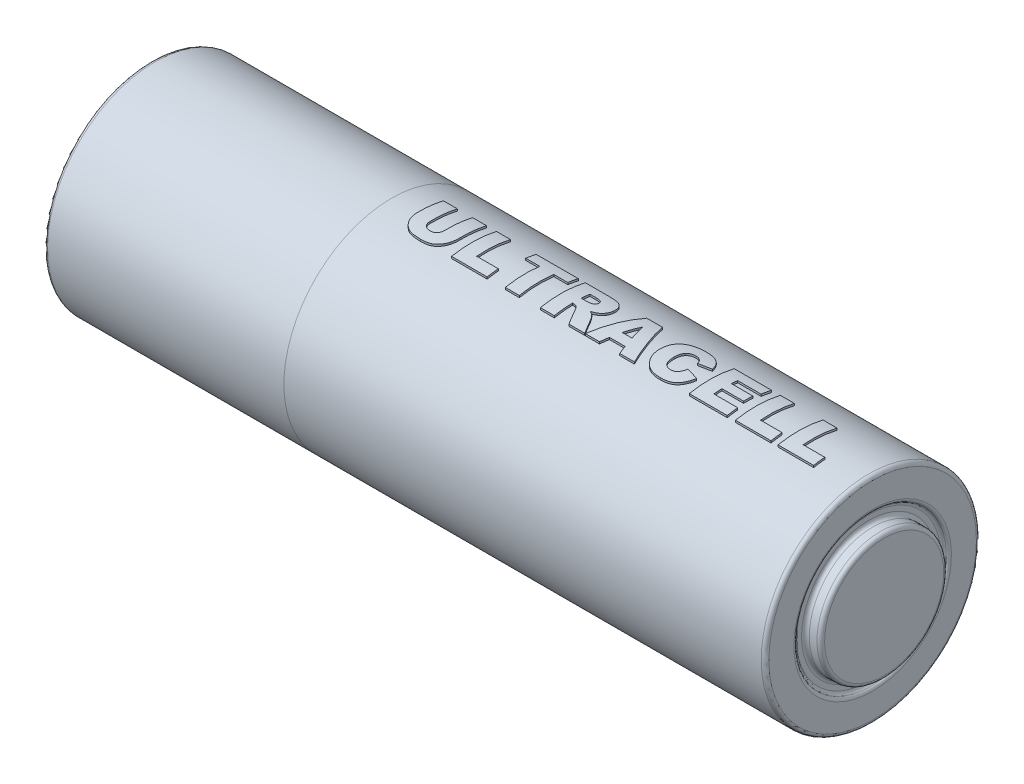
SolidWorks part; units mm, degrees
ref_plane "Plane1" through (0, 0, 0) normal (0, 0, 1) x (1, 0, 0)
ref_plane "Plane2" through (0, 0, 0) normal (0, 1, 0) x (1, 0, 0)
ref_plane "Plane3" through (0, 0, 0) normal (1, 0, 0) x (0, 0, -1)
sketch "Sketch1" plane through (0, 0, 0) normal (0, 0, 1) x (1, 0, 0)
  line L0 (0, 7.112) -> (47.6758, 7.112)
  line L1 (0, 7.112) -> (0, 0)
  line L2 (47.6758, 0) -> (0, 0)
  line L3 (47.6758, 0) -> (47.6758, 7.112)
  line L4 (0, 0) -> (47.6758, 0) construction
  dimension "BodyLength" = 47.6758
  dimension "BodyRadius" = 7.112
revolve "Base-Revolve" add sketch "Sketch1" angle 360 about L4
sketch "Sketch2" plane through (0, 0, 0) normal (-1, 0, 0) x (0, 0, 1)
  circle A0 centre (0, 0) radius 5.2578
  dimension "PositiveDepressionDiameter" = 10.5156
extrude "Cut-Extrude1" cut sketch "Sketch2" against normal blind 0.254
sketch "Sketch3" plane through (0.254, 0, 0) normal (-1, 0, 0) x (0, 0, 1)
  circle A0 centre (0, 0) radius 2.667
  dimension "PositiveExtentionDiameter" = 5.334
extrude "Boss-Extrude1" add sketch "Sketch3" along normal blind 1.524
sketch "Sketch4" plane through (47.6758, 0, 0) normal (1, 0, 0) x (0, 0, -1)
  circle A0 centre (0, 0) radius 4.953
  dimension "NegativeDepressionDiameter" = 9.906
extrude "Cut-Extrude2" cut sketch "Sketch4" against normal blind 0.254
sketch "Sketch5" plane through (47.4218, 0, 0) normal (1, 0, 0) x (0, 0, -1)
  circle A0 centre (0, 0) radius 4.191
  dimension "NegativeExtentionDiameter" = 8.382
extrude "Boss-Extrude2" add sketch "Sketch5" along normal blind 1.016
fillet "Fillet2" radius 0.254 4 edges at (0.254, -2.667, 0) (-1.27, -2.667, 0) (0, -7.112, 0) (0, -5.2578, 0)
fillet "Fillet3" radius 0.254 1 edges at (0.254, -5.2578, 0)
fillet "Fillet4" radius 0.254 4 edges at (47.6758, 4.953, 0) (47.4218, 4.191, 0) (48.4378, 4.191, 0) (47.6758, -7.112, 0)
fillet "Fillet5" radius 0.254 1 edges at (47.4218, 4.953, 0)
ref_plane "Plane5" through (0, 0, 40.2647) normal (0, 0, 1) x (1, 0, 0)
sketch "Sketch7" plane through (0, 0, 40.2647) normal (0, 0, 1) x (1, 0, 0)
  line L0 (15.875, 13.708) -> (15.875, -13.7786)
  line L1 (0, -50) -> (0, 50) construction
  dimension "D1" = 15.875
sketch "Sketch8" plane through (0, 0, 0) normal (0, 1, 0) x (1, 0, 0)
  text T0 "ULTRACELL" font "Arial Black" height in points 12
extrude "Boss-Extrude3" add sketch "Sketch8" along normal offset from surface (7.2058 mm away) 0.127
pattern_circular "CirPattern1" count 2 every 180 of "Boss-Extrude3"
